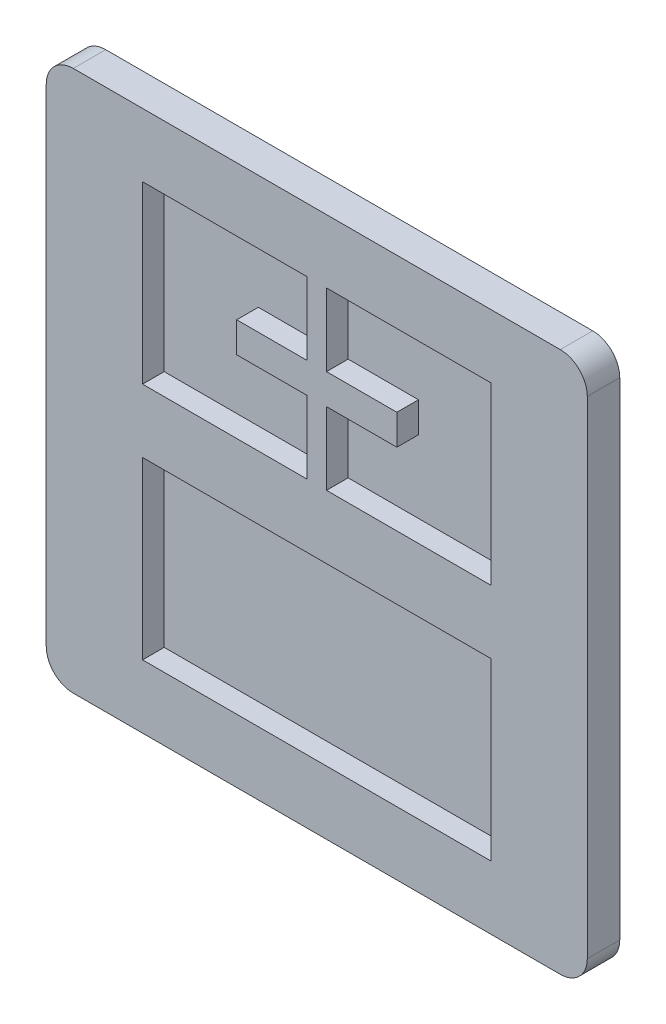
SolidWorks part; units mm, degrees
ref_plane "Ebene vorne" through (0, 0, 0) normal (0, 0, 1) x (1, 0, 0)
ref_plane "Ebene oben" through (0, 0, 0) normal (0, 1, 0) x (1, 0, 0)
ref_plane "Ebene rechts" through (0, 0, 0) normal (1, 0, 0) x (0, 0, -1)
sketch "Skizze2" plane through (0, 0, 0) normal (0, 0, 1) x (1, 0, 0)
  line L1 (-50, -50) -> (50, -50)
  line L2 (-50, -50) -> (-50, 50)
  line L3 (-50, 50) -> (50, 50)
  line L4 (50, -50) -> (50, 50)
  line L5 (-50, -50) -> (50, 50) construction
  line L6 (-50, 50) -> (50, -50) construction
  point P0 (0, 0)
  dimension "D1" = 100
  dimension "D2" = 100
extrude "Aufsatz-Linear austragen1" add sketch "Skizze2" along normal blind 2
sketch "Skizze3" plane through (0, 0, 2) normal (0, 0, 1) x (1, 0, 0)
  line L0 (0, 56.0816) -> (0, -59.0885) construction
  line L1 (-71.0482, 0) -> (73.0876, 0) construction
  line L2 (-50.3583, 22.0667) -> (3.0767, 22.0667) construction
  line L3 (-32, 38.0667) -> (-32, 6.0667)
  line L4 (-32, 6.0667) -> (-2, 6.0667)
  line L5 (-2, 6.0667) -> (-2, 19.0667)
  line L6 (-2, 19.0667) -> (-15, 19.0667)
  line L7 (-15, 19.0667) -> (-15, 25.0667)
  line L8 (-2, 25.0667) -> (-15, 25.0667)
  line L9 (-2, 38.0667) -> (-2, 25.0667)
  line L10 (-32, 38.0667) -> (-2, 38.0667)
  line L11 (2, 19.0667) -> (15, 19.0667)
  line L12 (2, 6.0667) -> (2, 19.0667)
  line L13 (32, 6.0667) -> (2, 6.0667)
  line L14 (32, 38.0667) -> (32, 6.0667)
  line L15 (32, 38.0667) -> (2, 38.0667)
  line L16 (2, 38.0667) -> (2, 25.0667)
  line L17 (2, 25.0667) -> (15, 25.0667)
  line L18 (15, 19.0667) -> (15, 25.0667)
  line L19 (-14.8, 19.2667) -> (-14.8, 24.8667)
  line L20 (-50, -50) -> (50, -50)
  line L21 (-50, -50) -> (-50, 50)
  line L22 (-50, 50) -> (50, 50)
  line L23 (50, -50) -> (50, 50)
  line L24 (-50, -50) -> (50, 50) construction
  line L25 (-50, 50) -> (50, -50) construction
  line L26 (-32, -38.0667) -> (32, -38.0667)
  line L27 (-32, -38.0667) -> (-32, -6.0667)
  line L28 (-32, -6.0667) -> (32, -6.0667)
  line L29 (32, -38.0667) -> (32, -6.0667)
  line L30 (-32, -38.0667) -> (32, -6.0667) construction
  line L31 (-32, -6.0667) -> (32, -38.0667) construction
  line L32 (-1.8, 24.8667) -> (-14.8, 24.8667)
  line L33 (-1.8, 38.2667) -> (-1.8, 24.8667)
  line L34 (-32.2, 38.2667) -> (-1.8, 38.2667)
  line L35 (-32.2, 38.2667) -> (-32.2, 5.8667)
  line L36 (-32.2, 5.8667) -> (-1.8, 5.8667)
  line L37 (-1.8, 5.8667) -> (-1.8, 19.2667)
  line L38 (-1.8, 19.2667) -> (-14.8, 19.2667)
  line L39 (1.8, 19.2667) -> (14.8, 19.2667)
  line L40 (14.8, 19.2667) -> (14.8, 24.8667)
  line L41 (1.8, 24.8667) -> (14.8, 24.8667)
  line L42 (1.8, 38.2667) -> (1.8, 24.8667)
  line L43 (32.2, 38.2667) -> (1.8, 38.2667)
  line L44 (32.2, 38.2667) -> (32.2, 5.8667)
  line L45 (32.2, 5.8667) -> (1.8, 5.8667)
  line L46 (1.8, 5.8667) -> (1.8, 19.2667)
  line L47 (-32.2, -38.2667) -> (-32.2, -5.8667)
  line L48 (-32.2, -5.8667) -> (32.2, -5.8667)
  line L49 (32.2, -38.2667) -> (32.2, -5.8667)
  line L50 (-32.2, -38.2667) -> (32.2, -38.2667)
  line L51 (-32.2, 5.8667) -> (-32.2, -5.8667) construction
  line L52 (-32.2, -38.2667) -> (-32.2, -50) construction
  line L53 (-32.2, 38.2667) -> (-32.2, 50) construction
  point P5 (0, -22.0667)
  point P15 (-15, 22.0667)
  point P18 (-32, 22.0667)
  point P26 (0, 0)
  dimension "D1" = 16
  dimension "D2" = 17
  dimension "D3" = 30
  dimension "D4" = 13
  dimension "D5" = 2
  dimension "D7" = 32
  dimension "D9" = 0.2
extrude "Aufsatz-Linear austragen2" add sketch "Skizze3" along normal blind 4 contours L50 L47 L48 L49 L38 L37 L36 L35 L34 L33 L32 L19 L45 L46 L39 L40 L41 L42 L43 L44 M31 M28 M29 M30
fillet "Verrundung1" radius 5 4 edges at (-50, -50, 3) (50, -50, 3) (50, 50, 3) (-50, 50, 3)
